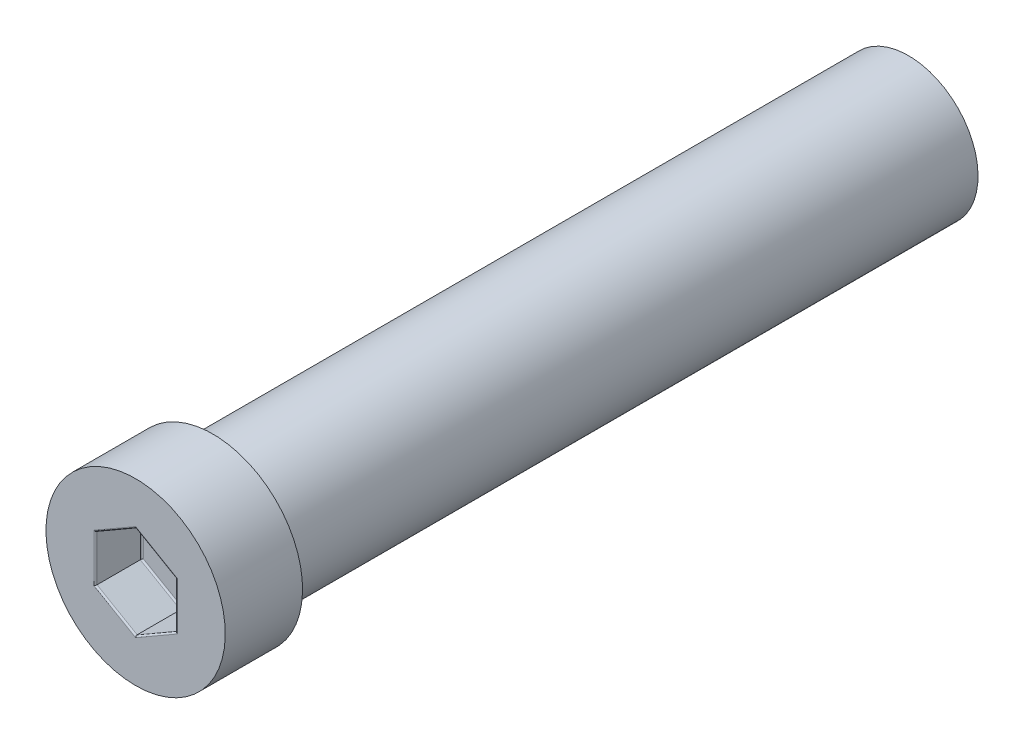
SolidWorks part; units mm, degrees
other "<Block Blot>-<Fillet2>"
ref_plane "Front Plane" through (0, 0, 0) normal (0, 0, 1) x (1, 0, 0)
ref_plane "Top Plane" through (0, 0, 0) normal (0, 1, 0) x (1, 0, 0)
ref_plane "Right Plane" through (0, 0, 0) normal (1, 0, 0) x (0, 0, -1)
mirrored part "Block Blot_Mirrored"
